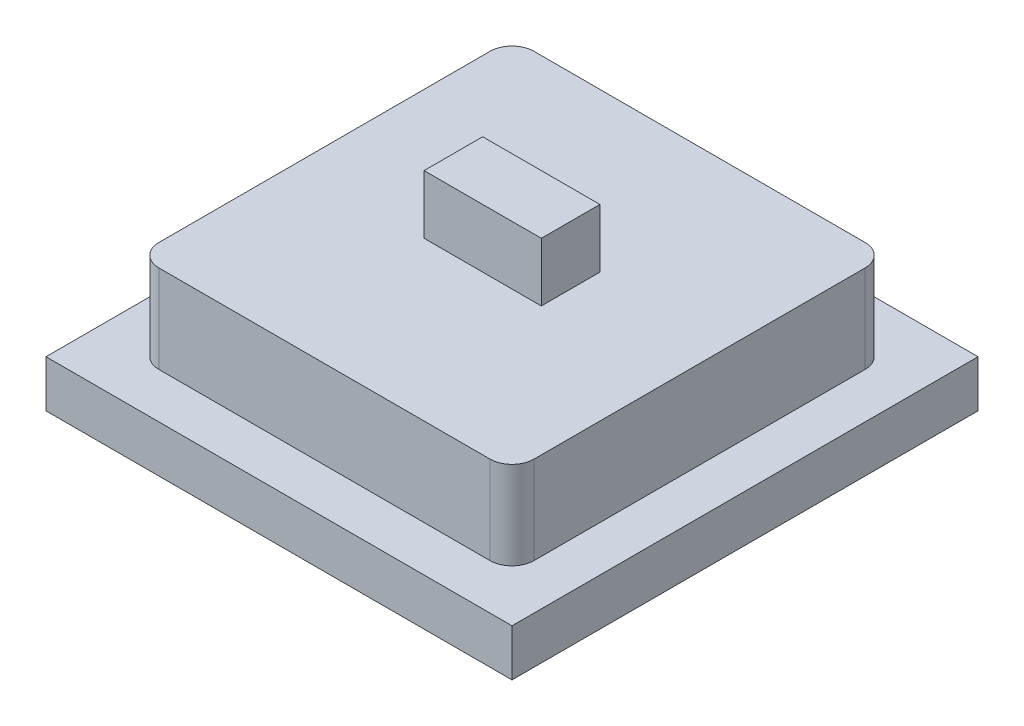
SolidWorks part; units mm, degrees
ref_plane "Front Plane" through (0, 0, 0) normal (0, 0, 1) x (1, 0, 0)
ref_plane "Top Plane" through (0, 0, 0) normal (0, 1, 0) x (1, 0, 0)
ref_plane "Right Plane" through (0, 0, 0) normal (1, 0, 0) x (0, 0, -1)
sketch "Sketch1" plane through (0, 0, 0) normal (0, 1, 0) x (1, 0, 0)
  line L1 (-5.65, -6.4) -> (5.65, -6.4)
  line L2 (-6.4, -5.65) -> (-6.4, 5.65)
  line L3 (-5.65, 6.4) -> (5.65, 6.4)
  line L4 (6.4, -5.65) -> (6.4, 5.65)
  line L5 (-6.4, -6.4) -> (6.4, 6.4) construction
  line L6 (-6.4, 6.4) -> (6.4, -6.4) construction
  arc A0 (-6.4, 5.65) -> (-5.65, 6.4) centre (-5.65, 5.65) cw
  arc A1 (5.65, 6.4) -> (6.4, 5.65) centre (5.65, 5.65) cw
  arc A2 (-5.65, -6.4) -> (-6.4, -5.65) centre (-5.65, -5.65) cw
  arc A3 (5.65, -6.4) -> (6.4, -5.65) centre (5.65, -5.65) ccw
  point P0 (0, 0)
  dimension "D3" = 0.75
  dimension "D1" = 12.8
  dimension "D2" = 12.8
extrude "Boss-Extrude1" add sketch "Sketch1" along normal blind 3
sketch "Sketch2" plane through (0, 0, 0) normal (0, -1, 0) x (1, 0, 0)
  line L1 (7.95, 7.95) -> (-7.95, 7.95)
  line L2 (7.95, 7.95) -> (7.95, -7.95)
  line L3 (7.95, -7.95) -> (-7.95, -7.95)
  line L4 (-7.95, 7.95) -> (-7.95, -7.95)
  line L5 (7.95, 7.95) -> (-7.95, -7.95) construction
  line L6 (7.95, -7.95) -> (-7.95, 7.95) construction
  point P0 (0, 0)
  dimension "D1" = 15.9
  dimension "D2" = 15.9
extrude "Boss-Extrude2" add sketch "Sketch2" along normal blind 1.6
sketch "Sketch3" plane through (0, 3, 0) normal (0, 1, 0) x (1, 0, 0)
  line L1 (2, -1) -> (-2, -1)
  line L2 (2, -1) -> (2, 1)
  line L3 (2, 1) -> (-2, 1)
  line L4 (-2, -1) -> (-2, 1)
  line L5 (2, -1) -> (-2, 1) construction
  line L6 (2, 1) -> (-2, -1) construction
  point P0 (0, 0)
  dimension "D1" = 2
  dimension "D2" = 4
extrude "Boss-Extrude3" add sketch "Sketch3" along normal blind 2
